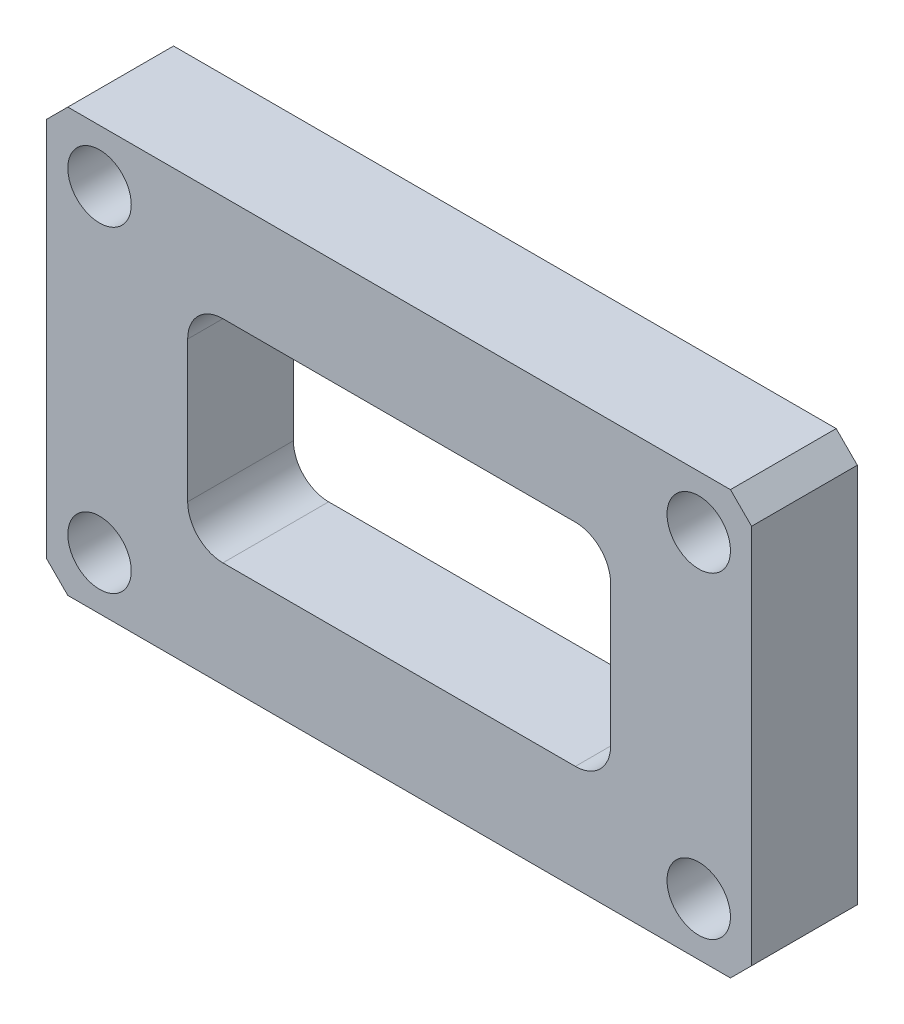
SolidWorks part; units mm, degrees
ref_plane "正面" through (0, 0, 0) normal (0, 0, 1) x (1, 0, 0)
ref_plane "平面" through (0, 0, 0) normal (0, 1, 0) x (1, 0, 0)
ref_plane "右側面" through (0, 0, 0) normal (1, 0, 0) x (0, 0, -1)
sketch "ｽｹｯﾁ1" plane through (0, 0, 0) normal (0, 0, 1) x (1, 0, 0)
  line L1 (-50, -30) -> (50, -30)
  line L2 (-50, -30) -> (-50, 30)
  line L3 (-50, 30) -> (50, 30)
  line L4 (50, -30) -> (50, 30)
  line L5 (-50, -30) -> (50, 30) construction
  line L6 (-50, 30) -> (50, -30) construction
  point P0 (0, 0)
  dimension "D1" = 100
  dimension "D2" = 60
extrude "ﾎﾞｽ - 押し出し1" add sketch "ｽｹｯﾁ1" along normal blind 15
sketch "ｽｹｯﾁ2" plane through (0, 0, 15) normal (0, 0, 1) x (1, 0, 0)
  line L1 (-30, -15) -> (30, -15)
  line L2 (-30, -15) -> (-30, 15)
  line L3 (-30, 15) -> (30, 15)
  line L4 (30, -15) -> (30, 15)
  line L5 (-30, -15) -> (30, 15) construction
  line L6 (-30, 15) -> (30, -15) construction
  point P0 (0, 0)
  dimension "D1" = 60
  dimension "D2" = 30
extrude "ｶｯﾄ - 押し出し1" cut sketch "ｽｹｯﾁ2" against normal up to next
fillet "ﾌｨﾚｯﾄ1" radius 5 4 edges at (30, -15, 7.5) (30, 15, 7.5) (-30, 15, 7.5) (-30, -15, 7.5)
chamfer "面取り1" distance 3 angle 45 4 edges at (-50, -30, 7.5) (50, -30, 7.5) (50, 30, 7.5) (-50, 30, 7.5)
hole_wizard "Ø9.0 (9) 直径の穴1" positions "ｽｹｯﾁ3" profile "ｽｹｯﾁ4" hole size "Ø9.0" standard "JIS"
sketch "ｽｹｯﾁ3" plane through (0, 0, 15) normal (0, 0, 1) x (1, 0, 0)
  line L1 (-42.5, -22.5) -> (42.5, -22.5)
  line L2 (-42.5, -22.5) -> (-42.5, 22.5)
  line L3 (-42.5, 22.5) -> (42.5, 22.5)
  line L4 (42.5, -22.5) -> (42.5, 22.5)
  line L5 (42.5, 22.5) -> (-42.5, -22.5)
  point P0 (-42.5, -22.5)
  point P1 (42.5, 22.5)
  point P38 (-42.5, 22.5)
  point P39 (42.5, -22.5)
  dimension "D1" = 85
  dimension "D2" = 45
sketch "ｽｹｯﾁ4" plane through (-42.5, -22.5, 15) normal (1, 0, 0) x (0, -1, 0)
  line L0 (0, 0) -> (0, 15)
  line L1 (0, 15) -> (4.5, 15)
  line L2 (4.5, 15) -> (4.5, 0)
  line L5 (4.5, 0) -> (0, 0)
  line L11 (0, -6.35) -> (0, 107.95) construction
  dimension "通し穴の直径" = 9
  dimension "通し穴の深さ" = 15
